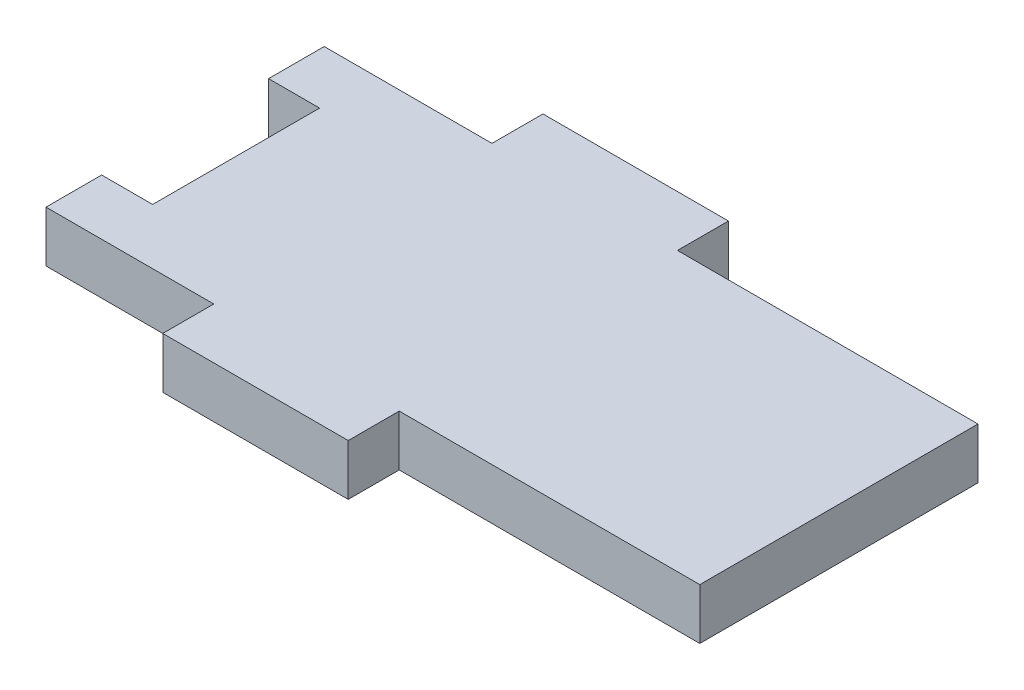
SolidWorks part; units mm, degrees
ref_plane "Alzado" through (0, 0, 0) normal (0, 0, 1) x (1, 0, 0)
ref_plane "Planta" through (0, 0, 0) normal (0, 1, 0) x (1, 0, 0)
ref_plane "Vista lateral" through (0, 0, 0) normal (1, 0, 0) x (0, 0, -1)
sketch "Croquis1" plane through (0, 0, 0) normal (0, 1, 0) x (1, 0, 0)
  line L2 (43.5424, 9.0429) -> (43.5424, -20.9571)
  line L4 (-21.4576, 3.0429) -> (-21.4576, -14.9571)
  line L5 (-26.9576, 9.0429) -> (-8.8676, 9.0429)
  line L6 (-26.9576, -20.9571) -> (-8.8676, -20.9571)
  line L7 (-26.9576, 9.0429) -> (-26.9576, 3.0429)
  line L8 (-26.9576, 3.0429) -> (-21.4576, 3.0429)
  line L10 (-26.9576, -20.9571) -> (-26.9576, -14.9571)
  line L11 (-26.9576, -14.9571) -> (-21.4576, -14.9571)
  line L12 (-8.8676, 14.5429) -> (11.1324, 14.5429)
  line L13 (11.1324, 14.5429) -> (11.1324, 9.0429)
  line L14 (-8.8676, 14.5429) -> (-8.8676, 9.0429)
  line L15 (-8.8676, -20.9571) -> (-8.8676, -26.4571)
  line L16 (-8.8676, -26.4571) -> (11.1324, -26.4571)
  line L17 (11.1324, -26.4571) -> (11.1324, -20.9571)
  line L18 (11.1324, 9.0429) -> (43.5424, 9.0429)
  line L19 (11.1324, -20.9571) -> (43.5424, -20.9571)
  point P0 (0, 0)
  dimension "D1" = 18.09
  dimension "D2" = 70.5
  dimension "D3" = 20
  dimension "D4" = 5.5
  dimension "D5" = 5.5
  dimension "D6" = 30
  dimension "D7" = 6
  dimension "D8" = 6
  dimension "D9" = 5.5
extrude "Saliente-Extruir1" add sketch "Croquis1" along normal blind 5.5
